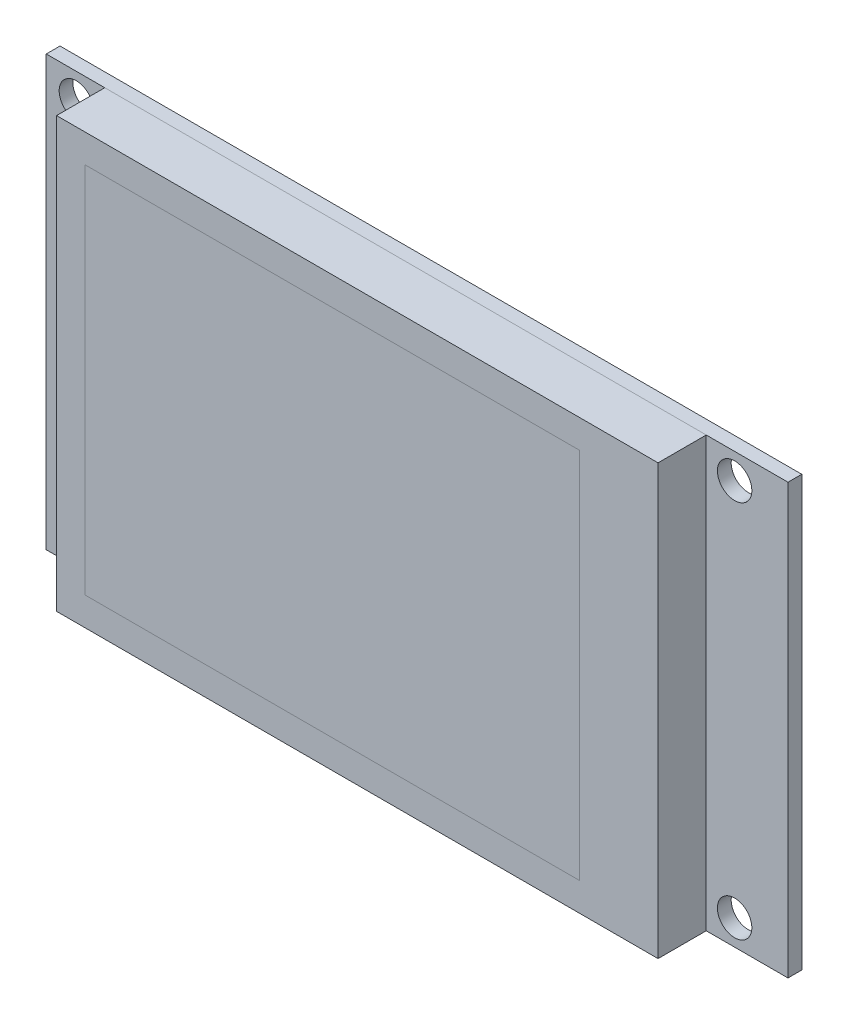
SolidWorks part; units mm, degrees
ref_plane "Front Plane" through (0, 0, 0) normal (0, 0, 1) x (1, 0, 0)
ref_plane "Top Plane" through (0, 0, 0) normal (0, 1, 0) x (1, 0, 0)
ref_plane "Right Plane" through (0, 0, 0) normal (1, 0, 0) x (0, 0, -1)
sketch "Esquisse4" plane through (0, 0, 0) normal (0, 0, 1) x (1, 0, 0)
  line L1 (-28.75, -21.65) -> (28.75, -21.65)
  line L2 (-28.75, -21.65) -> (-28.75, 21.65)
  line L3 (-28.75, 21.65) -> (28.75, 21.65)
  line L4 (28.75, -21.65) -> (28.75, 21.65)
  line L5 (-28.75, -21.65) -> (28.75, 21.65) construction
  line L6 (-28.75, 21.65) -> (28.75, -21.65) construction
  point P0 (0, 0)
  dimension "D1" = 57.5
  dimension "D2" = 43.3
extrude "Boss.-Extru.3" add sketch "Esquisse4" against normal blind 0.2
sketch "Esquisse5" plane through (0, 0, 0) normal (0, 0, 1) x (1, 0, 0)
  line L1 (-28.75, 21.65) -> (28.75, 21.65)
  line L2 (-28.75, 21.65) -> (-28.75, -21.65)
  line L3 (-28.75, -21.65) -> (28.75, -21.65)
  line L4 (28.75, 21.65) -> (28.75, -21.65)
  line L5 (-32.05, 24.95) -> (37.85, 24.95)
  line L6 (-32.05, 24.95) -> (-32.05, -24.95)
  line L7 (-32.05, -24.95) -> (37.85, -24.95)
  line L8 (37.85, 24.95) -> (37.85, -24.95)
  point P10 (-32.05, 0)
  dimension "D1" = 3.3
  dimension "D2" = 69.9
  dimension "D3" = 3.3
extrude "Boss.-Extru.4" add sketch "Esquisse5" against normal blind 5.6 separate body
sketch "Esquisse6" plane through (0, 0, -5.6) normal (0, 0, -1) x (-1, 0, 0)
  line L0 (-37.85, 24.95) -> (32.05, 24.95) construction
  line L1 (-47.35, 24.95) -> (38.85, 24.95)
  line L2 (-47.35, 24.95) -> (-47.35, -24.95)
  line L3 (-47.35, -24.95) -> (38.85, -24.95)
  line L4 (38.85, 24.95) -> (38.85, -24.95)
  line L5 (32.05, 24.95) -> (32.05, -24.95) construction
  point P6 (38.85, 0)
  dimension "D1" = 6.8
  dimension "D2" = 86.2
extrude "Boss.-Extru.5" add sketch "Esquisse6" along normal blind 1.6 separate body
sketch "Esquisse7" plane through (0, 0, -5.6) normal (0, 0, 1) x (1, 0, 0)
  line L0 (-35.35, 22) -> (41.15, 22) construction
  line L1 (-35.35, 22) -> (-35.35, -22) construction
  line L2 (37.85, 24.95) -> (-32.05, 24.95) construction
  circle A0 centre (-35.35, 22) radius 2
  circle A1 centre (-35.35, -22) radius 2
  circle A2 centre (41.15, 22) radius 2
  circle A3 centre (41.15, -22) radius 2
  point P8 (-35.35, 0)
  point P9 (2.9, 24.95)
  point P13 (2.9, 22)
  dimension "D3" = 4
  dimension "D1" = 76.5
  dimension "D2" = 44
extrude "Enlèv. mat.-Extru.1" cut sketch "Esquisse7" against normal through all
